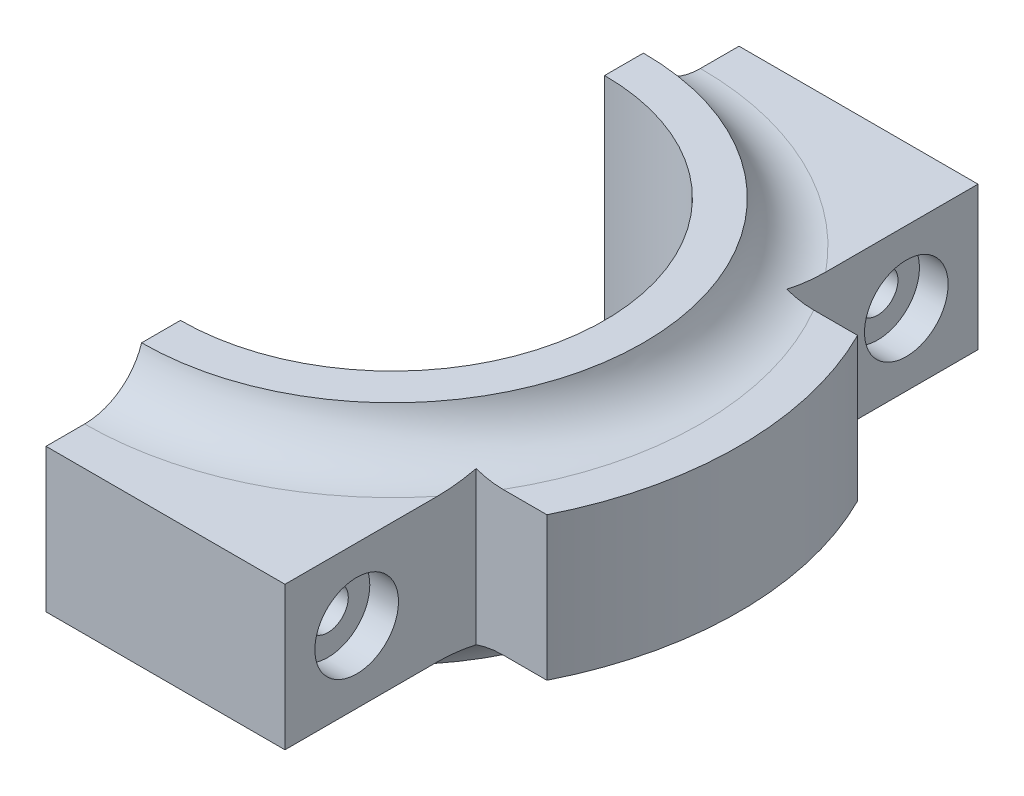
SolidWorks part; units mm, degrees
ref_plane "Front Plane" through (0, 0, 0) normal (0, 0, 1) x (1, 0, 0)
ref_plane "Top Plane" through (0, 0, 0) normal (0, 1, 0) x (1, 0, 0)
ref_plane "Right Plane" through (0, 0, 0) normal (1, 0, 0) x (0, 0, -1)
imported_body "Stock-Connecting Rod-1"
sketch "Sketch1" plane through (20, 0, 0) normal (1, 0, 0) x (0, 0, -1)
  line L0 (-23, 0) -> (23, 0) construction
  point P4 (0, 0)
  dimension "D1" = 23
hole_wizard "CBORE for M3 Pan Head Machine Screw1" positions "Sketch2" profile "Sketch3" counterbore size "M3" standard "ANSI Metric"
sketch "Sketch2" plane through (20, 0, 0) normal (1, 0, 0) x (0, 0, -1)
  point P0 (-23, 0)
  point P2 (23, 0)
  point P6 (-23, 0)
sketch "Sketch3" plane through (20, 0, 23) normal (0, 1, 0) x (0, 0, -1)
  line L0 (0, 0) -> (0, 31.0215)
  line L1 (0, 31.0215) -> (1.7, 30)
  line L2 (1.7, 30) -> (1.7, 2.4)
  line L3 (1.7, 2.4) -> (3.5, 2.4)
  line L4 (3.5, 2.4) -> (3.5, 0)
  line L5 (3.5, 0) -> (0, 0)
  line L6 (0, 31.0215) -> (-1.7, 30) construction
  line L7 (0, -6.35) -> (0, 107.95) construction
  dimension "Hole Dia." = 3.4
  dimension "Hole Depth" = 30
  dimension "C'Bore Dia." = 7
  dimension "C'Bore Depth" = 2.4
  dimension "Drill Angle" = 118
